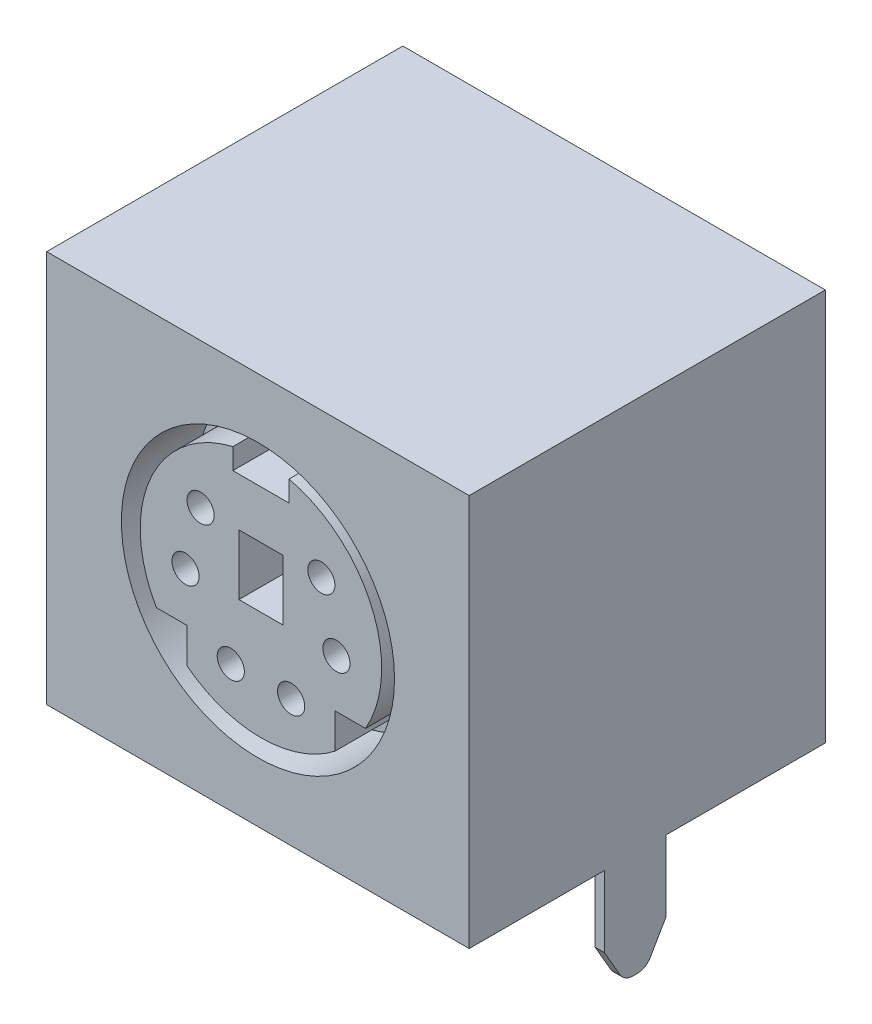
SolidWorks part; units mm, degrees
ref_plane "Front Plane" through (0, 0, 0) normal (0, 0, 1) x (1, 0, 0)
ref_plane "Top Plane" through (0, 0, 0) normal (0, 1, 0) x (1, 0, 0)
ref_plane "Right Plane" through (0, 0, 0) normal (1, 0, 0) x (0, 0, -1)
imported_body "Imported1"
other "DeleteFace1"
sketch "Sketch1" plane through (0, 0, -6.4) normal (0, 0, -1) x (-1, 0, 0)
  line L0 (7, -6.5) -> (-7, -6.5) construction
  line L1 (-6.5592, -6.5) -> (6.5592, -6.5)
  line L2 (-6.5592, -6.5) -> (-6.5592, -4.5424)
  line L3 (-6.5592, -4.5424) -> (6.5592, -4.5424)
  line L4 (6.5592, -6.5) -> (6.5592, -4.5424)
  point P6 (0, -6.5)
extrude "Extrude1" cut sketch "Sketch1" against normal blind 4
sketch "Sketch2" plane through (0, 0, 0) normal (1, 0, 0) x (0, 0, -1)
  line L0 (3.8064, -4.5424) -> (3.8064, -5.7927)
  line L1 (6.4, -6.5) -> (0.12, -6.5) construction
  line L2 (4.5137, -6.5) -> (6.993, -6.5)
  line L3 (2.4, -4.5424) -> (6.4, -4.5424) construction
  arc A0 (3.8064, -5.7927) -> (4.5137, -6.5) centre (4.5137, -5.7927) ccw
extrude "Extrude-Thin1" add sketch "Sketch2" along normal mid plane 9.398 thin
other "Move Face1"
sketch "Sketch4" plane through (0, 0, -6.993) normal (0, 0, -1) x (-1, 0, 0)
  line L0 (-4.699, -4.5424) -> (4.699, -4.5424) construction
  line L1 (0, -6.5) -> (0, 0) construction
  line L2 (-4.699, -6.5) -> (4.699, -6.5) construction
  line L3 (6.5592, -4.5424) -> (-6.5592, -4.5424) construction
  line L4 (-4.199, -6.5) -> (-3.449, -6.5)
  line L5 (-1.699, -6.5) -> (1.699, -6.5)
  line L6 (-1.699, -6.5) -> (-1.699, -4.5424)
  line L7 (-4.199, -6.5) -> (-4.199, -4.5424)
  line L8 (-4.199, -4.5424) -> (-3.449, -4.5424)
  line L9 (-3.449, -6.5) -> (-3.449, -4.5424)
  line L10 (4.199, -6.5) -> (4.199, -4.5424)
  line L11 (4.199, -6.5) -> (3.449, -6.5)
  line L12 (3.449, -6.5) -> (3.449, -4.5424)
  line L13 (4.199, -4.5424) -> (3.449, -4.5424)
  line L14 (2.949, -6.5) -> (2.949, -4.5424)
  line L15 (-2.949, -6.5) -> (-2.199, -6.5)
  line L16 (-2.949, -6.5) -> (-2.949, -4.5424)
  line L17 (-2.949, -4.5424) -> (-2.199, -4.5424)
  line L18 (-2.199, -6.5) -> (-2.199, -4.5424)
  line L19 (2.949, -6.5) -> (2.199, -6.5)
  line L20 (2.199, -6.5) -> (2.199, -4.5424)
  line L21 (2.949, -4.5424) -> (2.199, -4.5424)
  line L22 (-1.699, -4.5424) -> (1.699, -4.5424)
  line L23 (1.699, -6.5) -> (1.699, -4.5424)
  line L24 (-4.699, -6.25) -> (-4.699, -6.5) construction
  line L25 (-4.699, -4.5424) -> (-4.199, -4.5424) construction
  line L26 (-3.449, -4.5424) -> (-2.949, -4.5424) construction
  line L27 (-2.199, -4.5424) -> (-1.699, -4.5424) construction
  point P29 (0, -6.5)
  dimension "D1" = 0.5
  dimension "D2" = 0.75
extrude "Extrude2" cut sketch "Sketch4" against normal up to surface (4.593 mm away)
